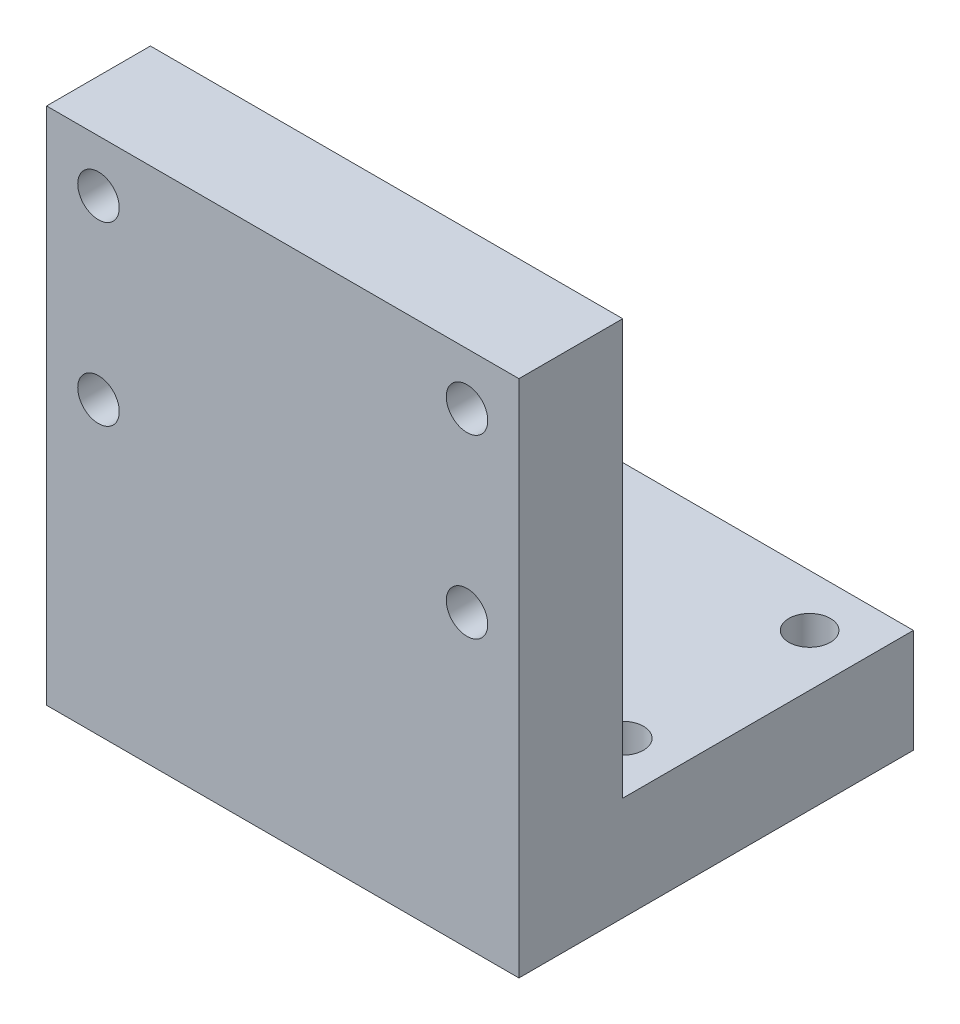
SolidWorks part; units mm, degrees
ref_plane "Front Plane" through (0, 0, 0) normal (0, 0, 1) x (1, 0, 0)
ref_plane "Top Plane" through (0, 0, 0) normal (0, 1, 0) x (1, 0, 0)
ref_plane "Right Plane" through (0, 0, 0) normal (1, 0, 0) x (0, 0, -1)
sketch "Sketch1" plane through (0, 0, 0) normal (0, 1, 0) x (1, 0, 0)
  line L0 (-22.75, 14) -> (0, 14)
  line L1 (-22.75, 14) -> (-22.75, -14)
  line L2 (-22.75, -14) -> (22.75, -14)
  line L3 (22.75, 14) -> (22.75, -14)
  line L4 (0, 14) -> (22.75, 14)
  line L5 (0, 14) -> (0, -14) construction
  line L6 (-22.75, 0) -> (22.75, 0) construction
  line L7 (-17.75, 9) -> (-17.75, -9) construction
  line L8 (-17.75, -9) -> (17.75, -9) construction
  line L9 (17.75, -9) -> (17.75, 9) construction
  line L10 (17.75, 9) -> (-17.75, 9) construction
  circle A0 centre (-17.75, 9) radius 2
  circle A1 centre (-17.75, -9) radius 2
  circle A2 centre (17.75, 9) radius 2
  circle A3 centre (17.75, -9) radius 2
  point P17 (0, 0)
  dimension "D3" = 4
  dimension "D5" = 4
  dimension "D6" = 4
  dimension "D7" = 4
  dimension "D9" = 5
  dimension "D10" = 5
  dimension "D1" = 45.5
  dimension "D2" = 28
  dimension "D4" = 18
  dimension "D8" = 35.5
extrude "Base Extrusion" add sketch "Sketch1" along normal blind 10
sketch "Sketch2" plane through (0, 0, 0) normal (0, -1, 0) x (1, 0, 0)
  line L0 (0, 14) -> (0, -14) construction
  line L1 (-22.75, 14) -> (22.75, 14) construction
  line L2 (22.75, -14) -> (-22.75, -14) construction
  circle A0 centre (-17.75, 9) radius 3
  circle A1 centre (-17.75, -9) radius 3
  circle A2 centre (17.75, -9) radius 3
  circle A3 centre (17.75, 9) radius 3
  dimension "D1" = 6
  dimension "D2" = 6
extrude "First Base Holes" cut sketch "Sketch2" against normal blind 6
sketch "Sketch5" plane through (0, 0, 0) normal (0, 1, 0) x (1, 0, 0)
  line L0 (-22.75, -14) -> (22.75, -14)
  line L1 (22.75, -14) -> (22.75, -24)
  line L2 (22.75, -24) -> (-22.75, -24)
  line L3 (-22.75, -24) -> (-22.75, -14)
  dimension "D1" = 10
extrude "Boss-Extrude3" add sketch "Sketch5" along normal blind 50
sketch "Sketch6" plane through (0, 0, 14) normal (0, 0, -1) x (-1, 0, 0)
  line L0 (-22.75, 50) -> (22.75, 50)
  line L1 (-22.75, 50) -> (-22.75, 23)
  line L2 (-22.75, 23) -> (22.75, 23)
  line L3 (22.75, 50) -> (22.75, 23)
  line L4 (22.75, 50) -> (16.5851, 50)
  line L5 (-17.75, 45) -> (-17.75, 28) construction
  line L6 (-17.75, 28) -> (17.75, 28) construction
  line L7 (17.75, 28) -> (17.75, 45) construction
  line L8 (17.75, 45) -> (-17.75, 45) construction
  circle A0 centre (-17.75, 45) radius 2
  circle A1 centre (-17.75, 28) radius 2
  circle A2 centre (17.75, 45) radius 2
  circle A3 centre (17.75, 28) radius 2
  point P13 (-22.75, 50)
  dimension "D3" = 4
  dimension "D5" = 4
  dimension "D6" = 4
  dimension "D7" = 4
  dimension "D9" = 5
  dimension "D10" = 5
  dimension "D1" = 45.5
  dimension "D2" = 27
  dimension "D4" = 17
  dimension "D8" = 35.5
extrude "Cut-Extrude2" cut sketch "Sketch6" against normal up to next contours A0 | A1 | A3 | A2
sketch "Sketch7" plane through (0, 0, 14) normal (0, 0, -1) x (-1, 0, 0)
  line L0 (0, 50) -> (0, 15.0631) construction
  line L1 (-22.75, 50) -> (22.75, 50) construction
  circle A0 centre (-17.75, 45) radius 3
  circle A1 centre (-17.75, 28) radius 3
  circle A2 centre (17.75, 28) radius 3
  circle A3 centre (17.75, 45) radius 3
  dimension "D1" = 6
  dimension "D2" = 6
extrude "Cut-Extrude3" cut sketch "Sketch7" against normal blind 6
